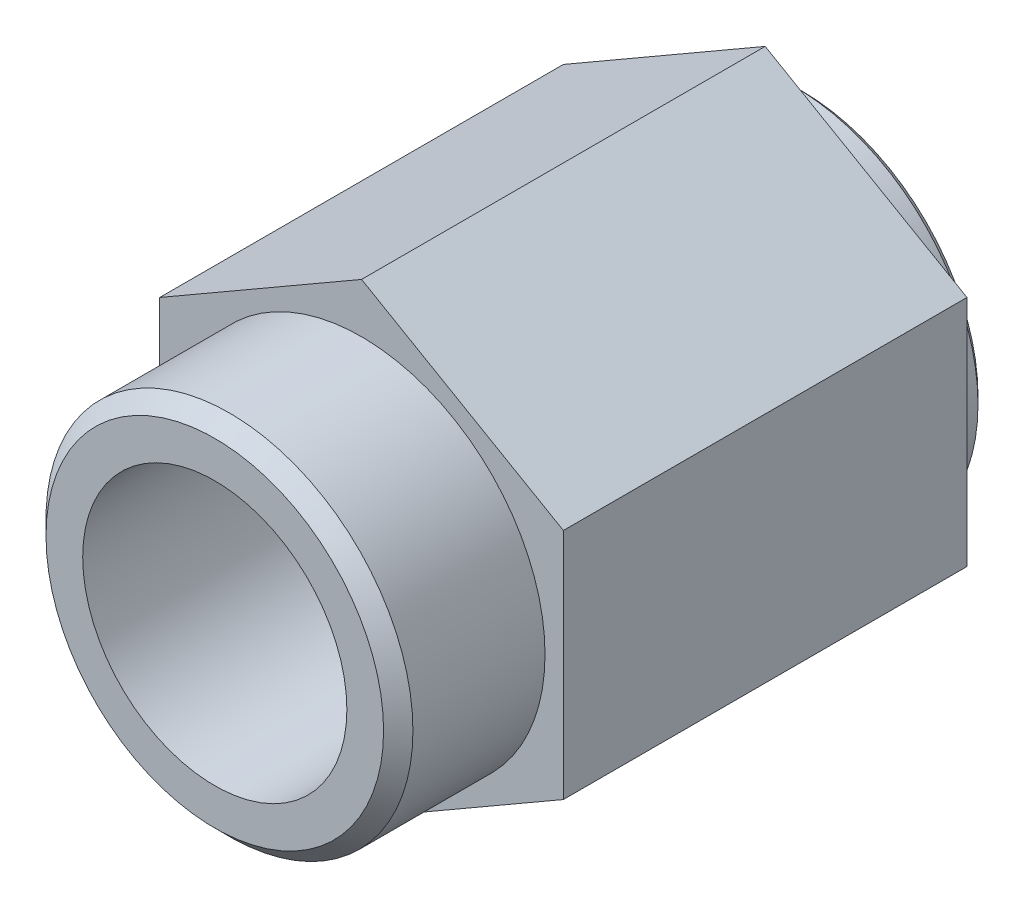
SolidWorks part; units mm, degrees
ref_plane "前视基准面" through (0, 0, 0) normal (0, 0, 1) x (1, 0, 0)
ref_plane "上视基准面" through (0, 0, 0) normal (0, 1, 0) x (1, 0, 0)
ref_plane "右视基准面" through (0, 0, 0) normal (1, 0, 0) x (0, 0, -1)
sketch "草图1" plane through (0, 0, 0) normal (0, 0, 1) x (1, 0, 0)
  line L1 (0, 31.7543) -> (-27.5, 15.8771)
  line L2 (-27.5, 15.8771) -> (-27.5, -15.8771)
  line L3 (-27.5, -15.8771) -> (0, -31.7543)
  line L4 (0, -31.7543) -> (27.5, -15.8771)
  line L5 (27.5, -15.8771) -> (27.5, 15.8771)
  line L6 (27.5, 15.8771) -> (0, 31.7543)
  circle A0 centre (0, 0) radius 27.5 construction
extrude "凸台-拉伸1" add sketch "草图1" along normal blind 55
sketch "草图2" plane through (0, 0, 55) normal (0, 0, 1) x (1, 0, 0)
  circle A0 centre (0, 0) radius 25
extrude "凸台-拉伸2" add sketch "草图2" along normal blind 20
sketch "草图3" plane through (0, 0, 0) normal (0, 0, -1) x (-1, 0, 0)
  circle A0 centre (0, 0) radius 25
extrude "凸台-拉伸3" add sketch "草图3" along normal blind 5
sketch "草图4" plane through (0, 0, -5) normal (0, 0, -1) x (-1, 0, 0)
  circle A0 centre (0, 0) radius 10
extrude "切除-拉伸1" cut sketch "草图4" against normal blind 40
sketch "草图5" plane through (0, 0, 75) normal (0, 0, 1) x (1, 0, 0)
  circle A0 centre (0, 0) radius 18
extrude "切除-拉伸2" cut sketch "草图5" against normal blind 40
chamfer "倒角1" distance 2 angle 45 1 edges at (25, 0, 75)
chamfer "倒角3" distance 1 angle 45 1 edges at (-25, 0, -5)
